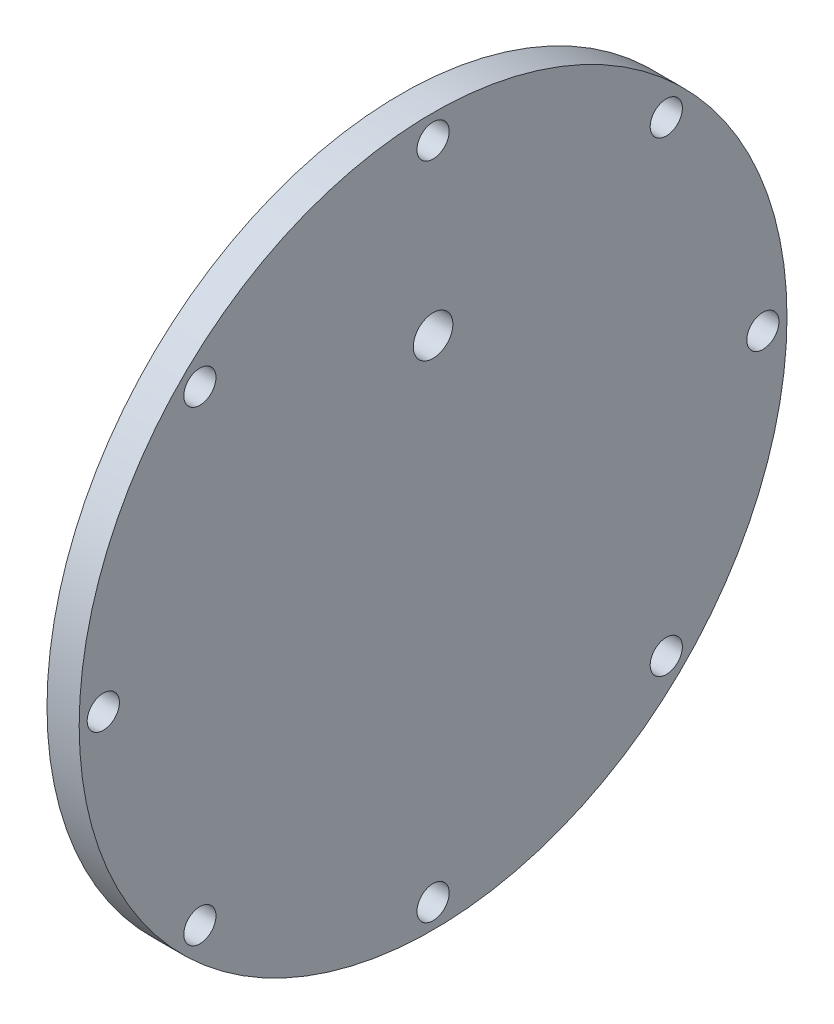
SolidWorks part; units mm, degrees
ref_plane "Front Plane" through (0, 0, 0) normal (0, 0, 1) x (1, 0, 0)
ref_plane "Top Plane" through (0, 0, 0) normal (0, 1, 0) x (1, 0, 0)
ref_plane "Right Plane" through (0, 0, 0) normal (1, 0, 0) x (0, 0, -1)
sketch "Sketch1" plane through (0, 0, 0) normal (1, 0, 0) x (0, 0, -1)
  circle A0 centre (0, 0) radius 69.85
  circle A1 centre (0, 65.0875) radius 3.175
  circle A2 centre (46.0238, 46.0238) radius 3.175
  circle A3 centre (65.0875, 0) radius 3.175
  circle A4 centre (46.0238, -46.0238) radius 3.175
  circle A5 centre (0, -65.0875) radius 3.175
  circle A6 centre (-46.0238, -46.0238) radius 3.175
  circle A7 centre (-65.0875, 0) radius 3.175
  circle A8 centre (-46.0238, 46.0238) radius 3.175
  point P6 (0, 0)
  point P21 (0, 0)
  dimension "D1" = 139.7
  dimension "D2" = 6.35
  dimension "D3" = 65.0875
  dimension "D4" = 8
extrude "Boss-Extrude1" add sketch "Sketch1" along normal blind 6.35
sketch "Sketch2" plane through (6.35, 0, 0) normal (1, 0, 0) x (0, 0, -1)
  circle A1 centre (0, 31.75) radius 3.9027
  point P0 (0, 29.869)
  dimension "D1" = 7.8054
  dimension "D2" = 31.75
extrude "Cut-Extrude1" cut sketch "Sketch2" against normal blind 6.35
